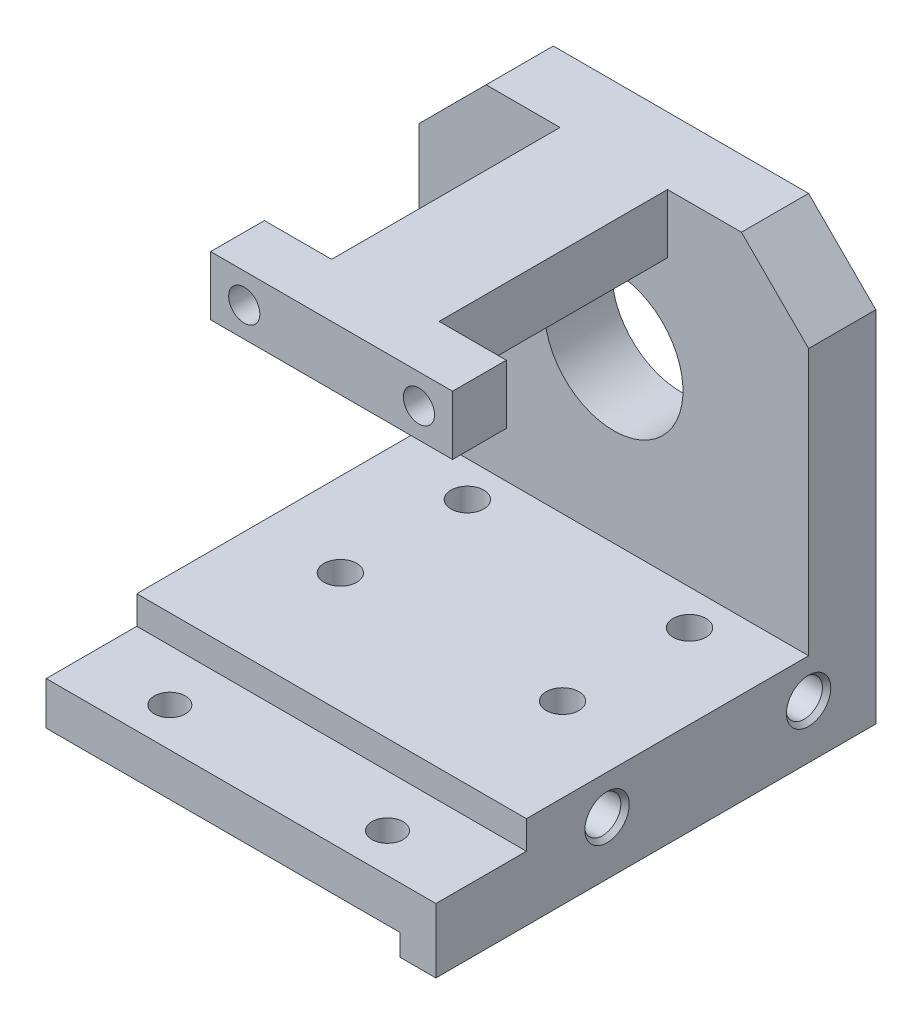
SolidWorks part; units mm, degrees
ref_plane "Front" through (0, 0, 0) normal (0, 0, 1) x (1, 0, 0)
ref_plane "Top" through (0, 0, 0) normal (0, 1, 0) x (1, 0, 0)
ref_plane "Right" through (0, 0, 0) normal (1, 0, 0) x (0, 0, -1)
sketch "Sketch1" plane through (0, 0, 0) normal (0, 0, 1) x (1, 0, 0)
  line L1 (-18.415, 15.748) -> (18.415, 15.748)
  line L2 (-18.415, 15.748) -> (-18.415, -22.479)
  line L3 (-18.415, -22.479) -> (18.415, -22.479)
  line L4 (18.415, 15.748) -> (18.415, -22.479)
  point P4 (0, -22.479)
  dimension "D1" = 36.83
  dimension "D2" = 38.227
  dimension "D3" = 22.479
extrude "Extrude1" add sketch "Sketch1" along normal blind 6.35
sketch "Sketch7" plane through (0, 0, 0) normal (0, 0, -1) x (-1, 0, 0)
  line L0 (18.415, 15.748) -> (18.415, -22.479) construction
  line L3 (-18.415, 15.748) -> (18.415, 15.748) construction
  circle A0 centre (14.605, 6.858) radius 2.4892
  dimension "D1" = 4.9784
  dimension "D2" = 3.81
  dimension "D3" = 8.89
extrude "Cut-Extrude1" [suppressed] cut sketch "Sketch7" against normal through all
sketch "Sketch8" plane through (0, 0, 0) normal (0, 0, -1) x (-1, 0, 0)
  line L0 (-18.415, -22.479) -> (-18.415, 15.748) construction
  line L1 (-18.415, -20.447) -> (18.415, -20.447) construction
  line L2 (18.415, 15.748) -> (18.415, -22.479) construction
  line L3 (18.415, -22.479) -> (-18.415, -22.479) construction
  circle A0 centre (-1.9685, -3.0644) radius 1.5875
  circle A1 centre (-1.9685, -3.0644) radius 14.2875 construction
  dimension "D1" = 3.175
  dimension "D2" = 28.575
  dimension "D3" = 2.159
  dimension "D5" = 2.032
  dimension "D6" = 3.0951
extrude "Extrude3" add sketch "Sketch8" along normal blind 0.0025
sketch "Sketch11" plane through (0, 0, 6.35) normal (0, 0, 1) x (1, 0, 0)
  circle A0 centre (18.415, 15.748) radius 9.525
  dimension "D1" = 19.05
extrude "Cut-Extrude2" [suppressed] cut sketch "Sketch11" against normal through all
chamfer "Chamfer1" [suppressed] distance 2.032 angle 45
sketch "Sketch12" plane through (0, 0, -0.0025) normal (0, 0, -1) x (-1, 0, 0)
  circle A0 centre (0, 0) radius 6.5405
  dimension "D1" = 13.081
extrude "Cut-Extrude3" cut sketch "Sketch12" against normal through all
sketch "Sketch13" plane through (0, 0, 6.35) normal (0, 0, 1) x (1, 0, 0)
  line L0 (18.415, -22.479) -> (18.415, 15.748) construction
  line L1 (-18.415, -22.479) -> (18.415, -22.479)
  line L2 (-18.415, -22.479) -> (-18.415, -15.748)
  line L3 (-18.415, -15.748) -> (18.415, -15.748)
  line L4 (18.415, -22.479) -> (18.415, -15.748)
  dimension "D1" = 6.731
extrude "Extrude4" add sketch "Sketch13" along normal blind 36.83
sketch "Sketch14" plane through (-18.415, 0, 0) normal (-1, 0, 0) x (0, 0, 1)
  line L0 (43.18, -22.479) -> (0, -22.479) construction
  line L1 (43.18, -15.748) -> (33.02, -15.748)
  line L2 (43.18, -15.748) -> (43.18, -18.415)
  line L3 (43.18, -18.415) -> (33.02, -18.415)
  line L4 (33.02, -15.748) -> (33.02, -18.415)
  dimension "D1" = 4.064
  dimension "D2" = 10.16
extrude "Cut-Extrude4" cut sketch "Sketch14" against normal through all
sketch "Sketch16" plane through (0, -22.479, 0) normal (0, -1, 0) x (1, 0, 0)
  line L0 (-18.415, 43.18) -> (18.415, 43.18) construction
  line L1 (18.415, 0) -> (15, 0)
  line L2 (18.415, 0) -> (18.415, 43.18)
  line L3 (18.415, 43.18) -> (15, 43.18)
  line L4 (15, 0) -> (15, 43.18)
  line L6 (-18.415, 0) -> (-15, 0)
  line L7 (-18.415, 0) -> (-18.415, 43.18)
  line L8 (-18.415, 43.18) -> (-15, 43.18)
  line L9 (-15, 0) -> (-15, 43.18)
  dimension "D1" = 3.415
  dimension "D2" = 3.415
extrude "Extrude5" add sketch "Sketch16" along normal blind 2.032
sketch "Sketch17" plane through (0, 0, 6.35) normal (0, 0, 1) x (1, 0, 0)
  line L0 (18.415, 15.748) -> (-18.415, 15.748) construction
  line L1 (-5.08, 15.748) -> (5.08, 15.748)
  line L2 (-5.08, 15.748) -> (-5.08, 10.16)
  line L3 (-5.08, 10.16) -> (5.08, 10.16)
  line L4 (5.08, 15.748) -> (5.08, 10.16)
  point P6 (0, 10.16)
  dimension "D1" = 5.588
  dimension "D2" = 10.16
extrude "Extrude6" add sketch "Sketch17" along normal up to surface (26.67 mm away)
sketch "Sketch18" plane through (-5.08, 0, 0) normal (-1, 0, 0) x (0, 0, 1)
  line L0 (33.02, 10.16) -> (6.35, 10.16) construction
  line L1 (33.02, 15.748) -> (27.94, 15.748)
  line L2 (33.02, 15.748) -> (33.02, 10.16)
  line L3 (33.02, 10.16) -> (27.94, 10.16)
  line L4 (27.94, 15.748) -> (27.94, 10.16)
  dimension "D1" = 5.08
extrude "Extrude7" add sketch "Sketch18" along normal blind 6.35
mirror "Mirror1" about plane through (0, 0, 0) normal (1, 0, 0) of "Extrude7"
hole_wizard "#32 (0.116000) Diameter Hole1" positions "Sketch20" profile "Sketch19" hole size "#32" standard "Ansi Inch"
sketch "Sketch20" plane through (0, 0, 27.94) normal (0, 0, -1) x (-1, 0, 0)
  line L2 (11.43, 10.16) -> (5.08, 15.748) construction
  point P0 (8.255, 12.954)
sketch "Sketch19" plane through (-8.255, 12.954, 27.94) normal (1, 0, 0) x (0, 1, 0)
  line L0 (0, 0) -> (0, 26.2852)
  line L1 (0, 26.2852) -> (1.4732, 25.4)
  line L2 (1.4732, 25.4) -> (1.4732, 0)
  line L5 (1.4732, 0) -> (0, 0)
  line L10 (0, 26.2852) -> (-1.4732, 25.4) construction
  line L11 (0, -6.35) -> (0, 107.95) construction
  dimension "Hole Dia." = 2.9464
  dimension "Hole Depth" = 25.4
  dimension "Drill Angle" = 118
mirror "Mirror2" about plane through (0, 0, 0) normal (1, 0, 0) of "#32 (0.116000) Diameter Hole1"
chamfer "Chamfer2" distance 6.35 angle 45 2 edges at (18.415, 15.748, 3.175) (-18.415, 15.748, 3.175)
sketch "Sketch21" plane through (-15, 0, 0) normal (1, 0, 0) x (0, 0, -1)
  line L1 (0, -22.479) -> (-43.18, -22.479)
  line L2 (0, -22.479) -> (0, -24.511)
  line L3 (0, -24.511) -> (-43.18, -24.511)
  line L4 (-43.18, -22.479) -> (-43.18, -24.511)
extrude "Cut-Extrude5" cut sketch "Sketch21" against normal through all
hole_wizard "#32 (0.116000) Diameter Hole2" positions "Sketch23" profile "Sketch22" hole size "#32" standard "Ansi Inch"
sketch "Sketch23" plane through (0, -22.479, 0) normal (0, -1, 0) x (1, 0, 0)
  line L0 (18.415, 0) -> (18.415, 43.18) construction
  line L1 (-18.415, 0) -> (15, 0) construction
  point P0 (10.16, 37.8944)
  point P1 (-10.414, 37.8944)
  dimension "D1" = 28.829
  dimension "D2" = 8.255
  dimension "D3" = 37.8944
  dimension "D4" = 37.8944
sketch "Sketch22" plane through (10.16, -22.479, 37.8944) normal (1, 0, 0) x (0, 0, -1)
  line L0 (0, 0) -> (0, 38.227)
  line L1 (0, 38.227) -> (1.4732, 38.227)
  line L2 (1.4732, 38.227) -> (1.4732, 0)
  line L5 (1.4732, 0) -> (0, 0)
  line L11 (0, -6.35) -> (0, 107.95) construction
  dimension "Thru Hole Dia." = 2.9464
  dimension "Thru Hole Depth" = 38.227
hole_wizard "M3.1 (3.100000) Diameter Hole1" positions "Sketch25" profile "Sketch24" hole size "M3.1" standard "Ansi Metric"
sketch "Sketch25" plane through (0, -15.748, 0) normal (0, 1, 0) x (-1, 0, 0)
  line L0 (-12.065, 0) -> (-18.415, 0) construction
  line L1 (18.415, 0) -> (12.065, 0) construction
  line L2 (-15, 0) -> (-18.415, 0) construction
  point P0 (-10.5, 9.69)
  point P1 (10.5, 9.69)
  point P2 (10.5, 21.69)
  point P3 (-10.5, 21.69)
  point P20 (15.24, 0)
  point P21 (-16.7075, 0)
  dimension "D1" = 9.69
  dimension "D2" = 9.69
  dimension "D3" = 21.69
  dimension "D4" = 21.69
  dimension "D5" = 10.5
  dimension "D6" = 10.5
  dimension "D7" = 10.5
  dimension "D8" = 10.5
sketch "Sketch24" plane through (10.5, -15.748, 9.69) normal (1, 0, 0) x (0, 0, 1)
  line L0 (0, 0) -> (0, 8.763)
  line L1 (0, 8.763) -> (1.55, 8.763)
  line L2 (1.55, 8.763) -> (1.55, 0)
  line L5 (1.55, 0) -> (0, 0)
  line L11 (0, -6.35) -> (0, 107.95) construction
  dimension "Thru Hole Dia." = 3.1
  dimension "Thru Hole Depth" = 8.763
sketch "Sketch26" plane through (0, 15.748, 0) normal (0, 1, 0) x (-1, 0, 0)
  line L1 (5.08, 6.35) -> (-5.08, 6.35)
  line L2 (5.08, 6.35) -> (5.08, 27.94)
  line L3 (5.08, 27.94) -> (-5.08, 27.94)
  line L4 (-5.08, 6.35) -> (-5.08, 27.94)
extrude "Cut-Extrude6" [suppressed] cut sketch "Sketch26" against normal blind 0.889
sketch "Sketch27" plane through (0, 0, 43.18) normal (0, 0, 1) x (1, 0, 0)
  line L1 (-18.415, -18.415) -> (18.415, -18.415)
  line L2 (-18.415, -18.415) -> (-18.415, -24.511)
  line L3 (-18.415, -24.511) -> (18.415, -24.511)
  line L4 (18.415, -18.415) -> (18.415, -24.511)
extrude "Cut-Extrude7" cut sketch "Sketch27" against normal offset from surface (1.6026 mm away) 8.5574
sketch "Sketch28" plane through (0, 15.748, 0) normal (0, 1, 0) x (-1, 0, 0)
  line L1 (-11.43, 33.02) -> (11.43, 33.02)
  line L2 (-11.43, 33.02) -> (-11.43, 27.94)
  line L3 (-11.43, 27.94) -> (11.43, 27.94)
  line L4 (11.43, 33.02) -> (11.43, 27.94)
extrude "Cut-Extrude8" [suppressed] cut sketch "Sketch28" against normal up to surface (0.889 mm away)
ref_plane "ball mount" through (0, -19.1135, 0) normal (0, -1, 0) x (1, 0, 0)
sketch "Sketch29" plane through (-18.415, 0, 0) normal (-1, 0, 0) x (0, 0, 1)
  line L0 (6.35, 9.398) -> (6.35, -15.748) construction
  line L1 (0, -22.479) -> (15.1678, -22.479)
  line L2 (0, -22.479) -> (0, -14.351)
  line L3 (0, -14.351) -> (6.35, -14.351)
  line L4 (6.35, -15.748) -> (6.35, -14.351)
  line L5 (6.35, -15.748) -> (15.1678, -15.748)
  line L6 (33.02, -15.748) -> (6.35, -15.748) construction
  line L7 (15.1678, -15.748) -> (15.1678, -22.479)
  dimension "D1" = 8.128
extrude "Extrude8" [suppressed] add sketch "Sketch29" along normal blind 8.255
chamfer "Chamfer3" [suppressed] distance 4.318 angle 60
hole_wizard "1/4-20 Tapped Hole1" positions "Sketch31" profile "Sketch30" tap size "1/4-20" standard "Ansi Inch"
sketch "Sketch31" plane through (-4.7978, 0, -8.3099) normal (-0.5, 0, -0.866) x (-0.866, 0, 0.5)
  line L0 (16.6199, -14.351) -> (25.2559, -22.479) construction
  point P0 (20.9379, -18.415)
sketch "Sketch30" plane through (-22.9305, -18.415, 2.159) normal (0, 1, 0) x (-0.866, 0, 0.5)
  line L0 (0, 0) -> (0, 11.43)
  line L1 (0, 11.43) -> (2.5527, 11.43)
  line L2 (2.5527, 11.43) -> (2.5527, 0)
  line L5 (2.5527, 0) -> (0, 0)
  line L10 (0, 11.43) -> (-2.5527, 11.43) construction
  line L11 (0, -6.35) -> (0, 107.95) construction
  dimension "Tap Drill Dia." = 5.1054
  dimension "Tap Drill Depth" = 11.43
  dimension "Drill Angle" = 180
sketch "Sketch32" [suppressed] plane through (0, -15.748, 0) normal (0, 1, 0) x (-1, 0, 0)
  line L1 (26.67, 6.35) -> (18.415, 6.35)
  line L2 (26.67, 6.35) -> (26.67, 15.1678)
  line L3 (26.67, 15.1678) -> (18.415, 15.1678)
  line L4 (18.415, 6.35) -> (18.415, 15.1678)
extrude "Extrude9" [suppressed] add sketch "Sketch32" along normal up to surface (1.397 mm away)
fillet "Fillet1" [suppressed] radius 6.604
fillet "Fillet2" [suppressed] radius 3.556
hole_wizard "M4x0.7 Tapped Hole1" positions "Sketch34" profile "Sketch33" tap size "M4x0.7" standard "Ansi Metric"
sketch "Sketch34" plane through (13.9065, 13.9065, 0) normal (0.7071, 0.7071, 0) x (0, 0, -1)
  line L0 (0, 2.6043) -> (-6.35, -6.376) construction
  point P0 (-3.175, -1.8859)
sketch "Sketch33" plane through (15.24, 12.573, 3.175) normal (0, 0, 1) x (-0.7071, 0.7071, 0)
  line L0 (0, 0) -> (0, 10.1)
  line L1 (0, 10.1) -> (1.65, 10.1)
  line L2 (1.65, 10.1) -> (1.65, 0)
  line L5 (1.65, 0) -> (0, 0)
  line L10 (0, 10.1) -> (-1.65, 10.1) construction
  line L11 (0, -6.35) -> (0, 107.95) construction
  dimension "Tap Drill Dia." = 3.3
  dimension "Tap Drill Depth" = 10.1
  dimension "Drill Angle" = 180
sketch "Sketch35" plane through (0, -15.748, 0) normal (0, 1, 0) x (-1, 0, 0)
  line L0 (-10.5, 9.69) -> (-10.5, 21.69) construction
  point P4 (-10.5, 15.69)
sketch "Sketch36" plane through (18.415, 0, 0) normal (1, 0, 0) x (0, 0, -1)
  line L0 (0, -24.511) -> (0, 9.398) construction
  line L1 (0, -24.511) -> (-41.5774, -24.511) construction
  point P0 (-6.35, -19.431)
  point P1 (-25.4, -19.431)
  dimension "D1" = 6.35
  dimension "D2" = 19.05
  dimension "D3" = 5.08
  dimension "D4" = 5.08
hole_wizard "#8-32 Tapped Hole2" positions "3DSketch2" profile "Sketch38" tap size "#8-32" standard "Ansi Inch"
sketch3d "3DSketch2"
  point P0 (18.415, -19.431, 6.35)
  point P3 (18.415, -19.431, 25.4)
sketch "Sketch38" plane through (18.415, -19.431, 6.35) normal (0, 1, 0) x (0, 0, -1)
  line L0 (0, 0) -> (0, 10.7188)
  line L1 (0, 10.7188) -> (1.7272, 10.7188)
  line L2 (1.7272, 10.7188) -> (1.7272, 0.4237)
  line L3 (1.7272, 0.4237) -> (2.0955, 0)
  line L5 (2.0955, 0) -> (0, 0)
  line L6 (-1.7272, 0.4237) -> (-2.0955, 0) construction
  line L10 (0, 10.7188) -> (-1.7272, 10.7188) construction
  line L11 (0, -6.35) -> (0, 107.95) construction
  dimension "Tap Drill Dia." = 3.4544
  dimension "Tap Drill Depth" = 10.7188
  dimension "Near C'Sink Dia." = 4.191
  dimension "Near C'Sink Angle" = 82
  dimension "Drill Angle" = 180
sketch "Sketch39" [suppressed] plane through (0, 0, 0) normal (0, 0, -1) x (-1, 0, 0)
  circle A0 centre (14.605, 6.858) radius 2.4892
extrude "Extrude10" [suppressed] add sketch "Sketch39" against normal up to surface (6.35 mm away)
sketch "Sketch41" plane through (0, 0, 0) normal (0, 0, -1) x (-1, 0, 0)
  circle A0 centre (0, 0) radius 6.5405
  circle A1 centre (0, 0) radius 13.97
  circle A2 centre (0, 0) radius 6.5405 construction
  dimension "D1" = 27.94
extrude "Cut-Extrude9" cut sketch "Sketch41" against normal blind 0.254
sketch "Sketch42" plane through (0, 0, 0.254) normal (0, 0, -1) x (-1, 0, 0)
  circle A0 centre (0, 0) radius 6.5405
  circle A1 centre (0, 0) radius 7.9375
  circle A2 centre (0, 0) radius 6.5405 construction
  dimension "D1" = 15.875
extrude "Boss-Extrude1" add sketch "Sketch42" along normal blind 0.254
